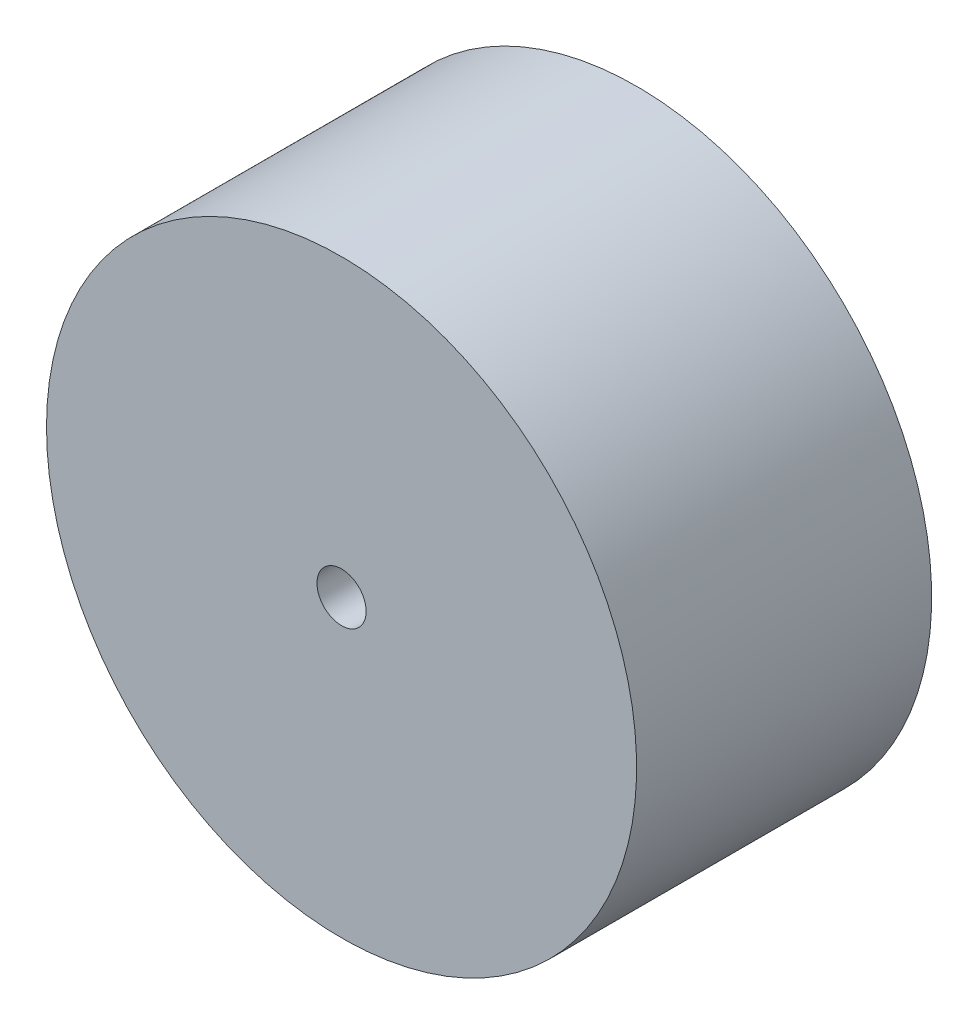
SolidWorks part; units mm, degrees
ref_plane "Front Plane" through (0, 0, 0) normal (0, 0, 1) x (1, 0, 0)
ref_plane "Top Plane" through (0, 0, 0) normal (0, 1, 0) x (1, 0, 0)
ref_plane "Right Plane" through (0, 0, 0) normal (1, 0, 0) x (0, 0, -1)
sketch "Sketch1" plane through (0, 0, 0) normal (0, 0, 1) x (1, 0, 0)
  circle A0 centre (0, 0) radius 38.1
  dimension "D1" = 76.2
extrude "Boss-Extrude1" add sketch "Sketch1" along normal blind 38.1
sketch "Sketch2" plane through (0, 0, 38.1) normal (0, 0, 1) x (1, 0, 0)
  circle A0 centre (0, 0) radius 3.175
  dimension "D1" = 6.35
extrude "Cut-Extrude1" cut sketch "Sketch2" against normal through all contours A0
